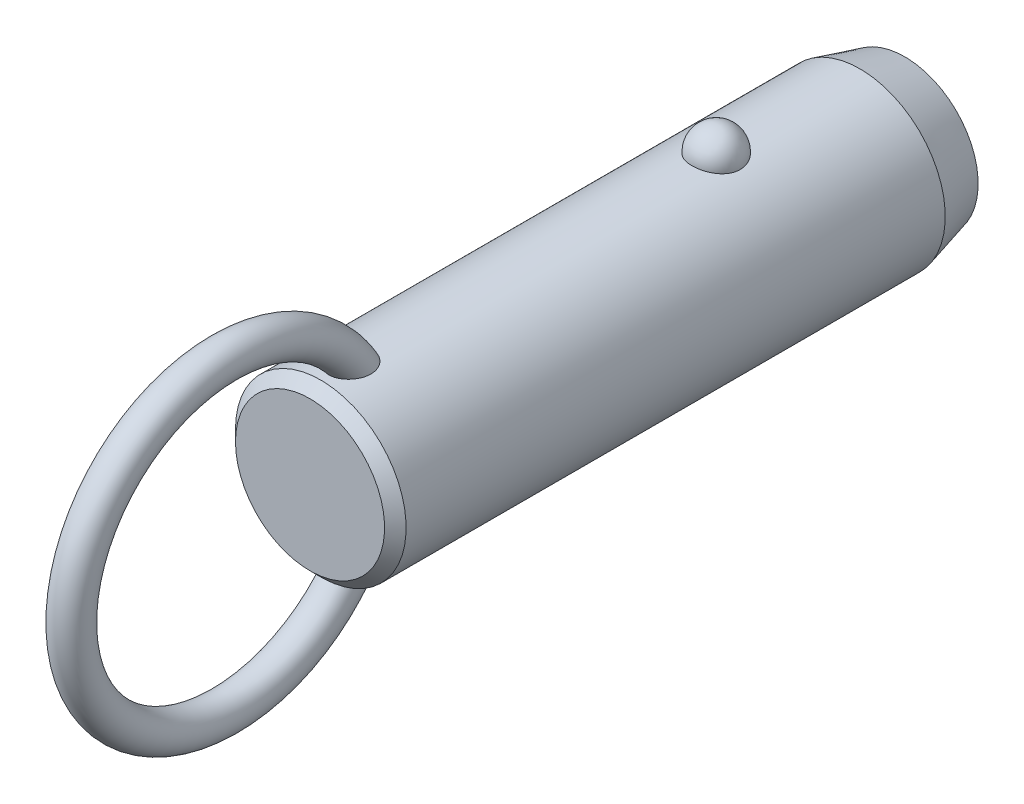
SolidWorks part; units mm, degrees
ref_plane "Front Plane" through (0, 0, 0) normal (0, 0, 1) x (1, 0, 0)
ref_plane "Top Plane" through (0, 0, 0) normal (0, 1, 0) x (1, 0, 0)
ref_plane "Right Plane" through (0, 0, 0) normal (1, 0, 0) x (0, 0, -1)
sketch "Sketch2" plane through (0, 0, 0) normal (0, 0, 1) x (1, 0, 0)
  circle A0 centre (0, 0) radius 9.5
  point P3 (0, 9.5)
  dimension "D1" = 19
extrude "Boss-Extrude1" add sketch "Sketch2" along normal blind 33
sketch "Sketch3" plane through (0, 0, 0) normal (0, 0, -1) x (-1, 0, 0)
  circle A0 centre (0, 0) radius 9.5
  dimension "D1" = 19
extrude "Boss-Extrude2" add sketch "Sketch3" along normal blind 23.7
chamfer "Chamfer1" distance 5 angle 15 1 edges at (-9.5, 0, -23.7)
sketch "Sketch12" plane through (0, 0, 0) normal (1, 0, 0) x (0, 0, -1)
  line L0 (-33, 9.5) -> (-33, -9.5) construction
  point P0 (-33, 0)
sketch "Sketch13" plane through (0, 0, 0) normal (1, 0, 0) x (0, 0, -1)
  circle A0 centre (-52.05, 0) radius 19.05
  point P2 (-33, 0)
  dimension "D1" = 38.1
sketch "Sketch14" plane through (0, 0, 0) normal (0, 1, 0) x (1, 0, 0)
  circle A0 centre (0, -35) radius 2
  point P2 (0, -33)
  dimension "D1" = 4
sweep "Sweep1" add profiles "Sketch14" path "Sketch13"
sketch "Sketch15" plane through (0, 0, 33) normal (0, 0, 1) x (1, 0, 0)
  circle A0 centre (0, 0) radius 9.5
  dimension "D1" = 19
extrude "Boss-Extrude3" add sketch "Sketch15" along normal blind 9.52
chamfer "Chamfer2" distance 1.2 angle 45 1 edges at (9.5, 0, 42.52)
sketch "Sketch18" plane through (0, 0, 0) normal (1, 0, 0) x (0, 0, -1)
  line L0 (18.7, 9.5) -> (-35.5378, 9.5) construction
  line L1 (2.7, 12.2) -> (2.7, 6.8)
  line L2 (-35.5378, -9.5) -> (18.7, -9.5) construction
  arc A0 (2.7, 12.2) -> (2.7, 6.8) centre (2.7, 9.5) ccw
  point P4 (0, 9.5)
  dimension "D1" = 21.7
revolve "Revolve1" add sketch "Sketch18" angle 360 about L1
